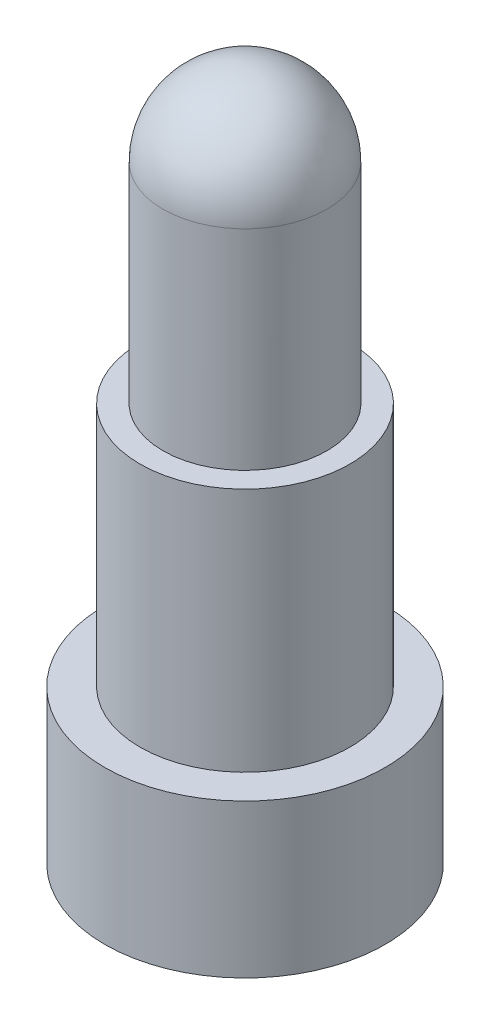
SolidWorks part; units mm, degrees
ref_plane "Front Plane" through (0, 0, 0) normal (0, 0, 1) x (1, 0, 0)
ref_plane "Top Plane" through (0, 0, 0) normal (0, 1, 0) x (1, 0, 0)
ref_plane "Right Plane" through (0, 0, 0) normal (1, 0, 0) x (0, 0, -1)
sketch "Sketch1" plane through (0, 0, 0) normal (0, 0, 1) x (1, 0, 0)
  line L0 (0, 0) -> (-0.915, 0)
  line L2 (0, 4.5) -> (0, 0) construction
  line L3 (0, 0) -> (0, 4.5)
  line L4 (-0.915, 0) -> (-0.915, 1)
  line L5 (-0.915, 1) -> (-0.685, 1)
  line L6 (-0.685, 1) -> (-0.685, 2.6)
  line L7 (-0.685, 2.6) -> (-0.535, 2.6)
  line L8 (-0.535, 2.6) -> (-0.535, 3.965)
  arc A2 (0, 4.5) -> (-0.535, 3.965) centre (0, 3.965) ccw
  point P2 (-0.3176, 4.0942)
  point P3 (-0.5327, 2.7743)
  point P4 (0, 0)
  point P9 (-0.535, 3.9211)
  point P12 (0, 0)
  point P13 (-0.535, 3.1)
  point P16 (-0.7149, 3.1)
  dimension "D1" = 4.5
  dimension "D2" = 0.915
  dimension "D3" = 2.6
  dimension "D4" = 0.535
  dimension "D5" = 0.15
  dimension "D6" = 1
revolve "Revolve1" add sketch "Sketch1" angle 360 about L2
